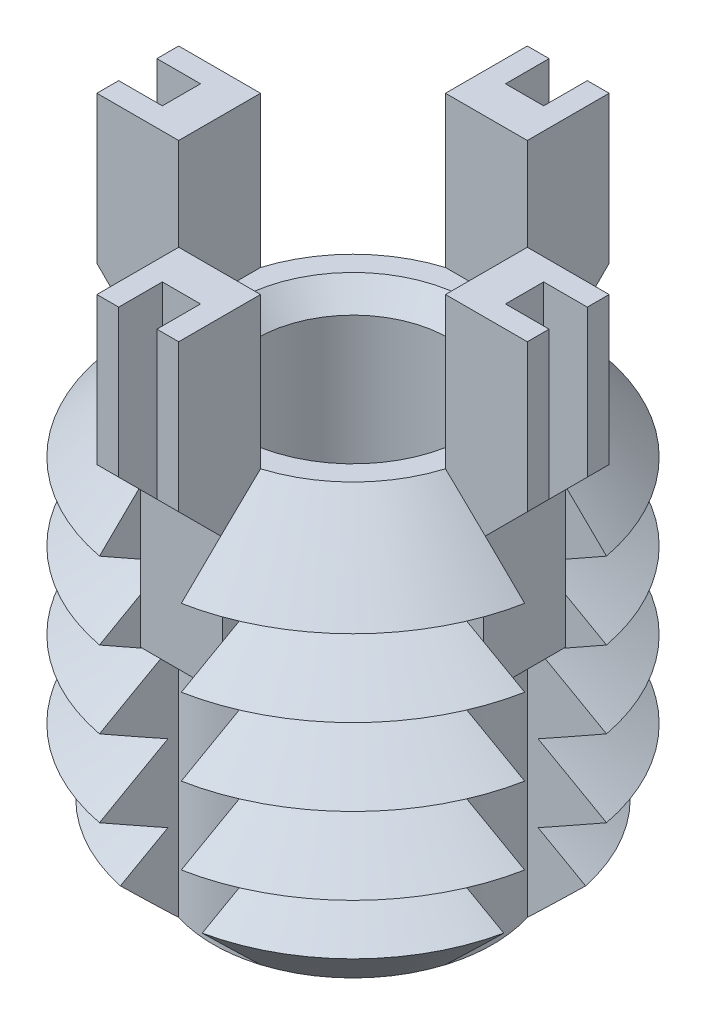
SolidWorks part; units mm, degrees
ref_plane "Front Plane" through (0, 0, 0) normal (0, 0, 1) x (1, 0, 0)
ref_plane "Top Plane" through (0, 0, 0) normal (0, 1, 0) x (1, 0, 0)
ref_plane "Right Plane" through (0, 0, 0) normal (1, 0, 0) x (0, 0, -1)
sketch "Sketch1" plane through (0, 0, 0) normal (0, 1, 0) x (1, 0, 0)
  circle A0 centre (0, 0) radius 3.969
  dimension "D1" = 7.938
extrude "Boss-Extrude1" add sketch "Sketch1" against normal blind 7.874
chamfer "Chamfer1" distance 1.411 angle 45 2 edges at (0, -7.874, 3.969) (0, 0, 3.969)
sketch "Sketch2" plane through (0, 0, 0) normal (1, 0, 0) x (0, 0, -1)
  line L0 (0, 0.8859) -> (0, -9.2617) construction
sketch "Sketch3" plane through (0, 0, 0) normal (1, 0, 0) x (0, 0, -1)
  line L0 (-3.969, -1.411) -> (-2.747, -2.1165)
  line L1 (-2.747, -2.1165) -> (-3.969, -2.822)
  line L2 (-3.969, -1.411) -> (-3.969, -6.463) construction
  line L3 (-3.969, -2.822) -> (-3.969, -1.411)
  dimension "D1" = 1.411
revolve "Cut-Revolve1" cut sketch "Sketch3" angle 360 about L0
pattern_linear "LPattern1" count 4 spacing 1.411 along (0, -1, 0) of "Cut-Revolve1"
sketch "Sketch4" plane through (0, 0, 0) normal (0, 1, 0) x (1, 0, 0)
  line L0 (-2.4456, 0.75) -> (-3.8975, 0.75)
  line L2 (-3.8975, -0.75) -> (-2.4456, -0.75)
  arc A0 (-2.4456, 0.75) -> (-2.4456, -0.75) centre (0, 0) ccw
  arc A1 (-3.8975, 0.75) -> (-3.8975, -0.75) centre (0, 0) ccw
  circle A2 centre (0, 0) radius 3.969 construction
  circle A3 centre (0, 0) radius 2.558 construction
  point P1 (-2.558, 0)
  point P3 (-3.969, 0)
  point P13 (0, 0)
  dimension "D1" = 1.5
extrude "Cut-Extrude1" cut sketch "Sketch4" against normal up to surface (7.874 mm away)
pattern_circular "CirPattern1" count 4 over 360 about axis through (0, 0, 0) along (0, 1, 0) of "Cut-Extrude1"
sketch "Sketch5" plane through (0, 0, 0) normal (1, 0, 0) x (0, 0, -1)
  line L0 (-2.4456, 2.767) -> (-2.4456, -3.233)
  line L1 (-2.4456, -3.233) -> (-3.1456, -3.233)
  line L2 (-3.1456, -3.233) -> (-3.1456, -0.733)
  line L3 (-3.1456, -0.733) -> (-3.9456, 0.067)
  line L4 (-3.9456, 0.067) -> (-3.9456, 2.767)
  line L5 (-3.9456, 2.767) -> (-2.4456, 2.767)
  line L6 (-3.8975, -4.233) -> (-0.75, -4.233) construction
  point P9 (-0.75, 0)
  point P10 (-3.1456, -0.733)
  dimension "D1" = 1
  dimension "D2" = 6
  dimension "D3" = 3.5
  dimension "D4" = 1.5
  dimension "D5" = 0.7
  dimension "D6" = 45
extrude "Boss-Extrude3" add sketch "Sketch5" along normal mid plane 1.5
pattern_circular "CirPattern2" count 4 over 360 about axis through (0, 0, 0) along (0, 1, 0) of "Boss-Extrude3"
sketch "Sketch6" plane through (0, 2.767, 0) normal (0, 1, 0) x (1, 0, 0)
  line L0 (-3.9456, -0.75) -> (-3.9456, 0.75) construction
  line L1 (-3.9456, -0.35) -> (-3.1456, -0.35)
  line L2 (-3.9456, -0.35) -> (-3.9456, 0.35)
  line L3 (-3.9456, 0.35) -> (-3.1456, 0.35)
  line L4 (-3.1456, -0.35) -> (-3.1456, 0.35)
  line L5 (-3.9456, -0.35) -> (-3.1456, 0.35) construction
  line L6 (-3.9456, 0.35) -> (-3.1456, -0.35) construction
  line L7 (3.9456, 0.75) -> (3.9456, -0.75) construction
  line L8 (-0.35, 3.1456) -> (0.35, 3.1456)
  line L9 (-0.35, 3.1456) -> (-0.35, 3.9456)
  line L10 (-0.35, 3.9456) -> (0.35, 3.9456)
  line L11 (0.35, 3.1456) -> (0.35, 3.9456)
  line L12 (-0.35, 3.1456) -> (0.35, 3.9456) construction
  line L13 (-0.35, 3.9456) -> (0.35, 3.1456) construction
  line L14 (3.1456, -0.35) -> (3.9456, -0.35)
  line L15 (3.1456, -0.35) -> (3.1456, 0.35)
  line L16 (3.1456, 0.35) -> (3.9456, 0.35)
  line L17 (3.9456, -0.35) -> (3.9456, 0.35)
  line L18 (3.1456, -0.35) -> (3.9456, 0.35) construction
  line L19 (3.1456, 0.35) -> (3.9456, -0.35) construction
  line L20 (-0.35, -3.9456) -> (0.35, -3.9456)
  line L21 (-0.35, -3.9456) -> (-0.35, -3.1456)
  line L22 (-0.35, -3.1456) -> (0.35, -3.1456)
  line L23 (0.35, -3.9456) -> (0.35, -3.1456)
  line L24 (-0.35, -3.9456) -> (0.35, -3.1456) construction
  line L25 (-0.35, -3.1456) -> (0.35, -3.9456) construction
  line L26 (-0.75, 3.9456) -> (0.75, 3.9456) construction
  line L27 (0.75, -3.9456) -> (-0.75, -3.9456) construction
  point P0 (-3.5456, 0)
  point P7 (-3.9456, 0)
  point P8 (-3.9456, 0)
  point P9 (0, 3.5456)
  point P14 (3.5456, 0)
  point P19 (0, -3.5456)
  point P24 (0, 3.9456)
  point P25 (3.9456, 0)
  point P26 (3.9456, 0)
  point P27 (0, 3.9456)
  point P30 (0, -3.9456)
  point P33 (0, -3.9456)
  dimension "D1" = 0.7
  dimension "D2" = 0.8
extrude "Cut-Extrude3" cut sketch "Sketch6" against normal through all both and the other way through all
sketch "Sketch7" plane through (0, 0, 0) normal (0, 1, 0) x (1, 0, 0)
  circle A0 centre (0, 0) radius 1.7525
  dimension "D1" = 3.505
extrude "Cut-Extrude4" cut sketch "Sketch7" against normal up to surface (7.874 mm away)
chamfer "Chamfer2" distance 0.397 angle 45 2 edges at (0, 0, 1.7525) (0, -7.874, 1.7525)
